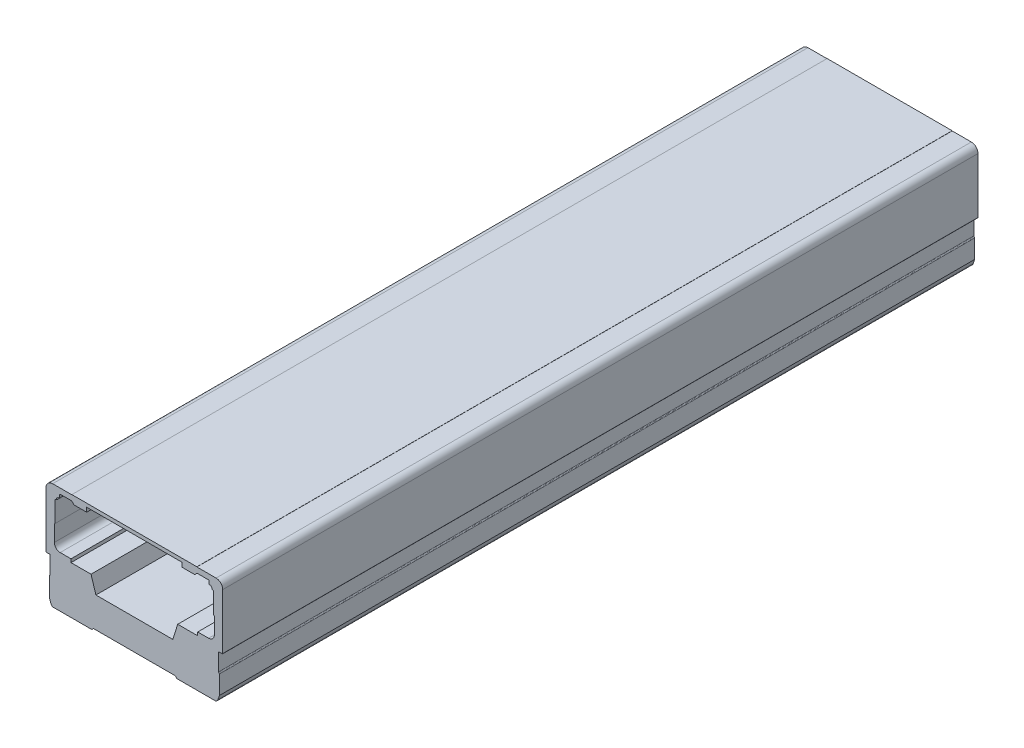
SolidWorks part; units mm, degrees
ref_plane "前视基准面" through (0, 0, 0) normal (0, 0, 1) x (1, 0, 0)
ref_plane "上视基准面" through (0, 0, 0) normal (0, 1, 0) x (1, 0, 0)
ref_plane "右视基准面" through (0, 0, 0) normal (1, 0, 0) x (0, 0, -1)
sketch "草图1" plane through (0, 0, 0) normal (0, 0, 1) x (1, 0, 0)
  line B0 (-47.6, 24.8371) -> (-48, 24.5371)
  line B1 (-47.6, 37.0752) -> (-47.6, 24.8371)
  line B2 (-46.7383, 38.5323) -> (-46.4578, 37.7807)
  line B3 (-45.0436, 39.1949) -> (-45.7952, 39.4754)
  line B4 (-44.8, 41.1371) -> (-44.8, 40.3371)
  line B5 (-37.6, 41.6371) -> (-44.3, 41.6371)
  line B6 (-36.2, 40.2371) -> (-37.6, 41.6371)
  line B7 (-28.6, 40.2371) -> (-36.2, 40.2371)
  line B8 (-28.6, 42.8371) -> (-28.6, 40.2371)
  line B9 (28.6, 42.8371) -> (-28.6, 42.8371)
  line B10 (28.6, 40.2371) -> (28.6, 42.8371)
  line B11 (36.2, 40.2371) -> (28.6, 40.2371)
  line B12 (37.6, 41.6371) -> (36.2, 40.2371)
  line B13 (44.3, 41.6371) -> (37.6, 41.6371)
  line B14 (44.8, 40.3371) -> (44.8, 41.1371)
  line B15 (45.7952, 39.4754) -> (45.0436, 39.1949)
  line B16 (46.4578, 37.7807) -> (46.7383, 38.5323)
  line B17 (47.6, 24.8371) -> (47.6, 37.0752)
  line B18 (48, 24.5371) -> (47.6, 24.8371)
  line B19 (48, 14.8371) -> (48, 24.5371)
  line B20 (38, 11.3371) -> (44.5, 11.3371)
  line B21 (38, 9.3371) -> (38, 11.3371)
  line B22 (26, 9.3371) -> (38, 9.3371)
  line B23 (23.056, 0) -> (26, 9.3371)
  line B24 (-23.056, 0) -> (23.056, 0)
  line B25 (-26, 9.3371) -> (-23.056, 0)
  line B26 (-38, 9.3371) -> (-26, 9.3371)
  line B27 (-38, 11.3371) -> (-38, 9.3371)
  line B28 (-44.5, 11.3371) -> (-38, 11.3371)
  line B29 (-48, 24.5371) -> (-48, 14.8371)
  line B30 (37.5, 44.8371) -> (37.5, 44.9371)
  line B31 (37.5, 44.9371) -> (-37.5, 44.9371)
  line B32 (-37.5, 44.9371) -> (-37.5, 44.8371)
  line B33 (-37.5, 44.8371) -> (-49, 44.8371)
  line B34 (-53, 40.8371) -> (-53, 7.6371)
  line B35 (-52.7, 7.3371) -> (-50.5, 7.3371)
  line B36 (-50.5, 7.3371) -> (-50.5, -3.1629)
  line B37 (-51, -4.0289) -> (-51, -15.1629)
  line B38 (-51, -15.1629) -> (-50.1378, -17.6669)
  line B39 (-49, -19.1629) -> (-25.5, -19.1629)
  line B40 (-25.5, -19.1629) -> (-24.5, -18.1629)
  line B41 (-24.5, -18.1629) -> (24.5, -18.1629)
  line B42 (24.5, -18.1629) -> (25.5, -19.1629)
  line B43 (25.5, -19.1629) -> (49, -19.1629)
  line B44 (50.1365, -17.6706) -> (51, -15.1629)
  line B45 (51, -15.1629) -> (51, -4.0289)
  line B46 (50.5, -3.1629) -> (50.5, 7.3371)
  line B47 (50.5, 7.3371) -> (52.7, 7.3371)
  line B48 (53, 7.6371) -> (53, 40.8371)
  line B49 (49, 44.8371) -> (37.5, 44.8371)
  arc B50 (-47.1758, 37.5695) -> (-47.6, 37.0752) centre (-47.1, 37.0752) ccw
  arc B51 (-47.1758, 37.5695) -> (-46.4578, 37.7807) centre (-47.6, 40.3371) ccw
  arc B52 (-46.7383, 38.5323) -> (-45.7952, 39.4754) centre (-47.6, 40.3371) ccw
  arc B53 (-45.0436, 39.1949) -> (-44.8, 40.3371) centre (-47.6, 40.3371) ccw
  arc B54 (-44.3, 41.6371) -> (-44.8, 41.1371) centre (-44.3, 41.1371) ccw
  arc B55 (44.8, 41.1371) -> (44.3, 41.6371) centre (44.3, 41.1371) ccw
  arc B56 (44.8, 40.3371) -> (45.0436, 39.1949) centre (47.6, 40.3371) ccw
  arc B57 (45.7952, 39.4754) -> (46.7383, 38.5323) centre (47.6, 40.3371) ccw
  arc B58 (46.4578, 37.7807) -> (47.1758, 37.5695) centre (47.6, 40.3371) ccw
  arc B59 (47.6, 37.0752) -> (47.1758, 37.5695) centre (47.1, 37.0752) ccw
  arc B60 (44.5, 11.3371) -> (48, 14.8371) centre (44.5, 14.8371) ccw
  arc B61 (-48, 14.8371) -> (-44.5, 11.3371) centre (-44.5, 14.8371) ccw
  arc B62 (-49, 44.8371) -> (-53, 40.8371) centre (-49, 40.8371) ccw
  arc B63 (-53, 7.6371) -> (-52.7, 7.3371) centre (-52.7, 7.6371) ccw
  arc B64 (-50.75, -3.5959) -> (-50.5, -3.1629) centre (-51, -3.1629) ccw
  arc B65 (-50.75, -3.5959) -> (-51, -4.0289) centre (-50.5, -4.0289) ccw
  arc B66 (-50.1378, -17.6669) -> (-49, -19.1629) centre (-47.3012, -16.6902) ccw
  arc B67 (49, -19.1629) -> (50.1365, -17.6706) centre (47.3012, -16.6902) ccw
  arc B68 (51, -4.0289) -> (50.75, -3.5959) centre (50.5, -4.0289) ccw
  arc B69 (50.5, -3.1629) -> (50.75, -3.5959) centre (51, -3.1629) ccw
  arc B70 (52.7, 7.3371) -> (53, 7.6371) centre (52.7, 7.6371) ccw
  arc B71 (53, 40.8371) -> (49, 44.8371) centre (49, 40.8371) ccw
sketch_block_instance "块1-1"
sketch_block "块1"
extrude "凸台-拉伸1" add sketch "草图1" along normal blind 453
hole_wizard "M5 螺纹孔1" positions "草图2" profile "草图3" tap size "M5" standard "GB"
sketch "草图2" plane through (0, -19.1629, 0) normal (0, -1, 0) x (-1, 0, 0)
  line L0 (0, -453) -> (0, -464.3791) construction
  line L1 (24.5, -453) -> (-24.5, -453) construction
  line L2 (49, -453) -> (25.5, -453) construction
  point P0 (42.5, -422.5)
  point P9 (-42.5, -422.5)
  point P13 (42.5, -222.5)
  point P15 (42.5, -22.5)
  point P17 (42.5, 177.5)
  point P19 (42.5, 377.5)
  point P21 (42.5, 577.5)
  point P23 (42.5, 777.5)
  point P27 (-42.5, 577.5)
  point P28 (-42.5, 377.5)
  point P29 (-42.5, 177.5)
  point P30 (-42.5, -22.5)
  point P31 (-42.5, -222.5)
  dimension "D1" = 85
  dimension "D2" = 30.5
  dimension "D3" = 200
  dimension "D4" = 200
  dimension "D5" = 200
  dimension "D6" = 200
  dimension "D7" = 200
  dimension "D8" = 200
sketch "草图3" plane through (-42.5, -19.1629, 422.5) normal (1, 0, 0) x (0, 0, -1)
  line L0 (0, 0) -> (0, 12.6618)
  line L1 (0, 12.6618) -> (2.1, 11.4)
  line L2 (2.1, 11.4) -> (2.1, 0)
  line L5 (2.1, 0) -> (0, 0)
  line L10 (0, 12.6618) -> (-2.1, 11.4) construction
  line L11 (0, -6.35) -> (0, 107.95) construction
  dimension "螺纹孔钻头直径" = 4.2
  dimension "螺纹孔钻头深度" = 11.4
  dimension "导头角度" = 118
